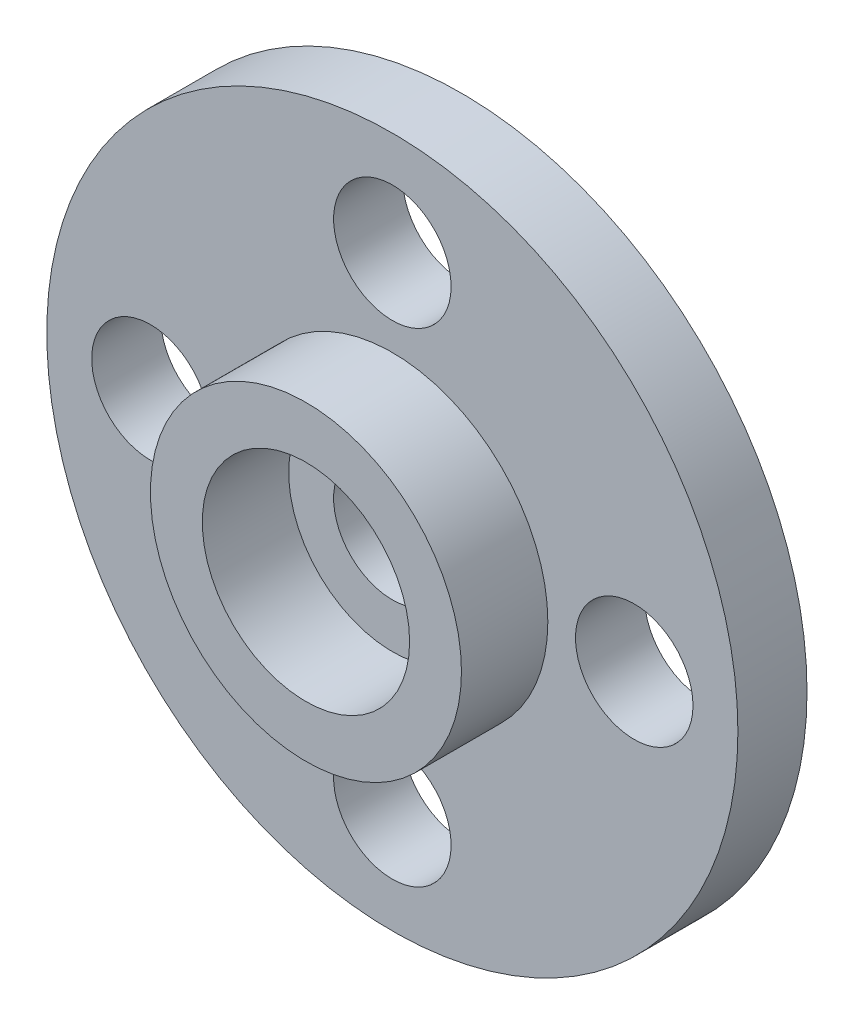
SolidWorks part; units mm, degrees
ref_plane "Front Plane" through (0, 0, 0) normal (0, 0, 1) x (1, 0, 0)
ref_plane "Top Plane" through (0, 0, 0) normal (0, 1, 0) x (1, 0, 0)
ref_plane "Right Plane" through (0, 0, 0) normal (1, 0, 0) x (0, 0, -1)
sketch "Sketch1" plane through (0, 0, 0) normal (0, 0, 1) x (1, 0, 0)
  circle A0 centre (0, 0) radius 10
  dimension "D1" = 20
extrude "Boss-Extrude1" add sketch "Sketch1" along normal blind 2
hole_wizard "M3 Clearance Hole1" positions "Sketch2" profile "Sketch3" hole size "M3" standard "ISO"
sketch "Sketch2" plane through (0, 0, 2) normal (0, 0, 1) x (1, 0, 0)
  line L0 (0, 10) -> (0, -10) construction
  line L2 (-10, 0) -> (10, 0) construction
  circle A0 centre (0, 0) radius 10 construction
  point P0 (-7, 0)
  point P2 (7, 0)
  point P4 (0, 7)
  point P6 (0, -7)
  point P23 (0, 0)
  dimension "D1" = 14
  dimension "D2" = 14
sketch "Sketch3" plane through (-7, 0, 2) normal (1, 0, 0) x (0, -1, 0)
  line L0 (0, 0) -> (0, 2)
  line L1 (0, 2) -> (1.7, 2)
  line L2 (1.7, 2) -> (1.7, 0)
  line L5 (1.7, 0) -> (0, 0)
  line L11 (0, -6.35) -> (0, 107.95) construction
  dimension "Thru Hole Dia." = 3.4
  dimension "Thru Hole Depth" = 2
sketch "Sketch4" plane through (0, 0, 2) normal (0, 0, 1) x (1, 0, 0)
  circle A0 centre (0, 0) radius 4.5
  dimension "D1" = 9
extrude "Extrude-Thin1" add sketch "Sketch4" along normal blind 2.5 thin
